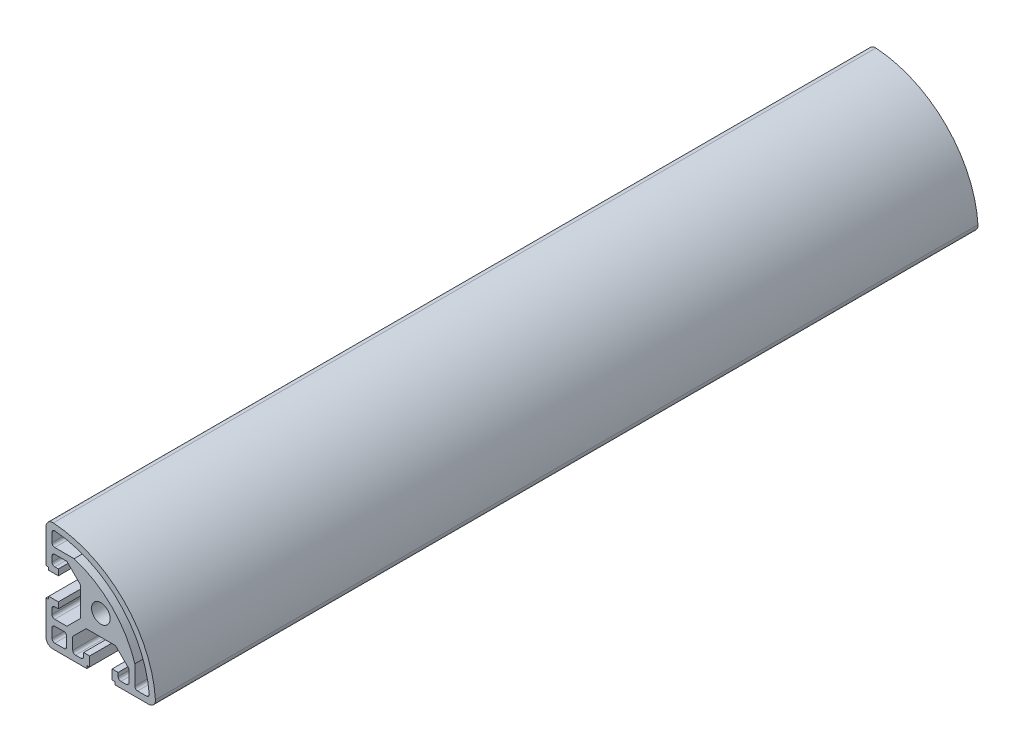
SolidWorks part; units mm, degrees
ref_plane "前视基准面" through (0, 0, 0) normal (0, 0, 1) x (1, 0, 0)
ref_plane "上视基准面" through (0, 0, 0) normal (0, 1, 0) x (1, 0, 0)
ref_plane "右视基准面" through (0, 0, 0) normal (1, 0, 0) x (0, 0, -1)
sketch "草图1" plane through (0, 0, 0) normal (0, 0, 1) x (1, 0, 0)
  line B0 (-17.8, -13.45) -> (-17.8, -16.8)
  line B1 (-16.8, -17.8) -> (-13.45, -17.8)
  line B2 (-12.45, -16.8) -> (-12.45, -13.45)
  line B3 (-13.45, -12.45) -> (-16.8, -12.45)
  line B4 (-20, 17.4166) -> (-20, 5.1)
  line B5 (17.4166, -20) -> (5.1, -20)
  line B6 (-20, 5.1) -> (-19, 5.1)
  line B7 (5.1, -20) -> (5.1, -19)
  line B8 (-19, 5.1) -> (-19, 4.1)
  line B9 (5.1, -19) -> (4.1, -19)
  line B10 (-19, 4.1) -> (-15.5, 4.1)
  line B11 (4.1, -19) -> (4.1, -15.5)
  line B12 (-15.5, 4.1) -> (-15.5, 6.3)
  line B13 (4.1, -15.5) -> (6.3, -15.5)
  line B14 (-15.5, 6.3) -> (-16.8, 6.3)
  line B15 (6.3, -15.5) -> (6.3, -16.8)
  line B16 (-17.8, 9.25) -> (-17.8, 7.3)
  line B17 (9.25, -17.8) -> (7.3, -17.8)
  line B18 (-16.8, 10.25) -> (-12.3713, 10.25)
  line B19 (10.25, -16.8) -> (10.25, -12.3713)
  line B20 (-12.3713, 10.25) -> (-7.5, 5.3787)
  line B21 (10.25, -12.3713) -> (5.3787, -7.5)
  line B22 (-7.5, 0) -> (-7.5, 5.3787)
  line B23 (0, -7.5) -> (5.3787, -7.5)
  line B24 (-7.5, 0) -> (-7.5, -5.3787)
  line B25 (0, -7.5) -> (-5.3787, -7.5)
  line B26 (-12.3713, -10.25) -> (-7.5, -5.3787)
  line B27 (-10.25, -12.3713) -> (-5.3787, -7.5)
  line B28 (-16.8, -10.25) -> (-12.3713, -10.25)
  line B29 (-10.25, -16.8) -> (-10.25, -12.3713)
  line B30 (-17.8, -9.25) -> (-17.8, -7.3)
  line B31 (-9.25, -17.8) -> (-7.3, -17.8)
  line B32 (-15.5, -6.3) -> (-16.8, -6.3)
  line B33 (-6.3, -15.5) -> (-6.3, -16.8)
  line B34 (-15.5, -4.1) -> (-15.5, -6.3)
  line B35 (-4.1, -15.5) -> (-6.3, -15.5)
  line B36 (-19, -4.1) -> (-15.5, -4.1)
  line B37 (-4.1, -19) -> (-4.1, -15.5)
  line B38 (-19, -5.1) -> (-19, -4.1)
  line B39 (-5.1, -19) -> (-4.1, -19)
  line B40 (-20, -5.1) -> (-19, -5.1)
  line B41 (-5.1, -20) -> (-5.1, -19)
  line B42 (-20, -5.1) -> (-20, -17.5)
  line B43 (-5.1, -20) -> (-17.5, -20)
  line B44 (-17.8009, 16.6607) -> (-17.8009, 13.4116)
  line B45 (-16.8009, 12.4116) -> (-9.7292, 12.4116)
  line B46 (12.4116, -9.7292) -> (12.4116, -16.8009)
  line B47 (13.4116, -17.8009) -> (16.6607, -17.8009)
  arc B48 (-16.8, -12.45) -> (-17.8, -13.45) centre (-16.8, -13.45) ccw
  arc B49 (-17.8, -16.8) -> (-16.8, -17.8) centre (-16.8, -16.8) ccw
  arc B50 (-13.45, -17.8) -> (-12.45, -16.8) centre (-13.45, -16.8) ccw
  arc B51 (-12.45, -13.45) -> (-13.45, -12.45) centre (-13.45, -13.45) ccw
  arc B52 (19.911, -17.3333) -> (-17.3333, 19.911) centre (-20, -20) ccw
  arc B53 (-17.3333, 19.911) -> (-20, 17.4166) centre (-17.5, 17.4166) ccw
  arc B54 (17.4166, -20) -> (19.911, -17.3333) centre (17.4166, -17.5) ccw
  arc B55 (-17.8, 7.3) -> (-16.8, 6.3) centre (-16.8, 7.3) ccw
  arc B56 (6.3, -16.8) -> (7.3, -17.8) centre (7.3, -16.8) ccw
  arc B57 (-16.8, 10.25) -> (-17.8, 9.25) centre (-16.8, 9.25) ccw
  arc B58 (9.25, -17.8) -> (10.25, -16.8) centre (9.25, -16.8) ccw
  arc B59 (-17.8, -9.25) -> (-16.8, -10.25) centre (-16.8, -9.25) ccw
  arc B60 (-10.25, -16.8) -> (-9.25, -17.8) centre (-9.25, -16.8) ccw
  arc B61 (-16.8, -6.3) -> (-17.8, -7.3) centre (-16.8, -7.3) ccw
  arc B62 (-7.3, -17.8) -> (-6.3, -16.8) centre (-7.3, -16.8) ccw
  arc B63 (-20, -17.5) -> (-17.5, -20) centre (-17.5, -17.5) ccw
  arc B64 (17.6569, -16.714) -> (-16.714, 17.6569) centre (-20, -20) ccw
  arc B65 (-16.714, 17.6569) -> (-17.8009, 16.6607) centre (-16.8009, 16.6607) ccw
  arc B66 (-17.8009, 13.4116) -> (-16.8009, 12.4116) centre (-16.8009, 13.4116) ccw
  arc B67 (12.4116, -9.7292) -> (-9.7292, 12.4116) centre (-20, -20) ccw
  arc B68 (12.4116, -16.8009) -> (13.4116, -17.8009) centre (13.4116, -16.8009) ccw
  arc B69 (16.6607, -17.8009) -> (17.6569, -16.714) centre (16.6607, -16.8009) ccw
  circle B70 centre (0, 0) radius 3.4
sketch_block_instance "A$C5C2472F5-1"
sketch_block "A$C5C2472F5"
extrude "凸台-拉伸1" add sketch "草图1" along normal mid plane 300
